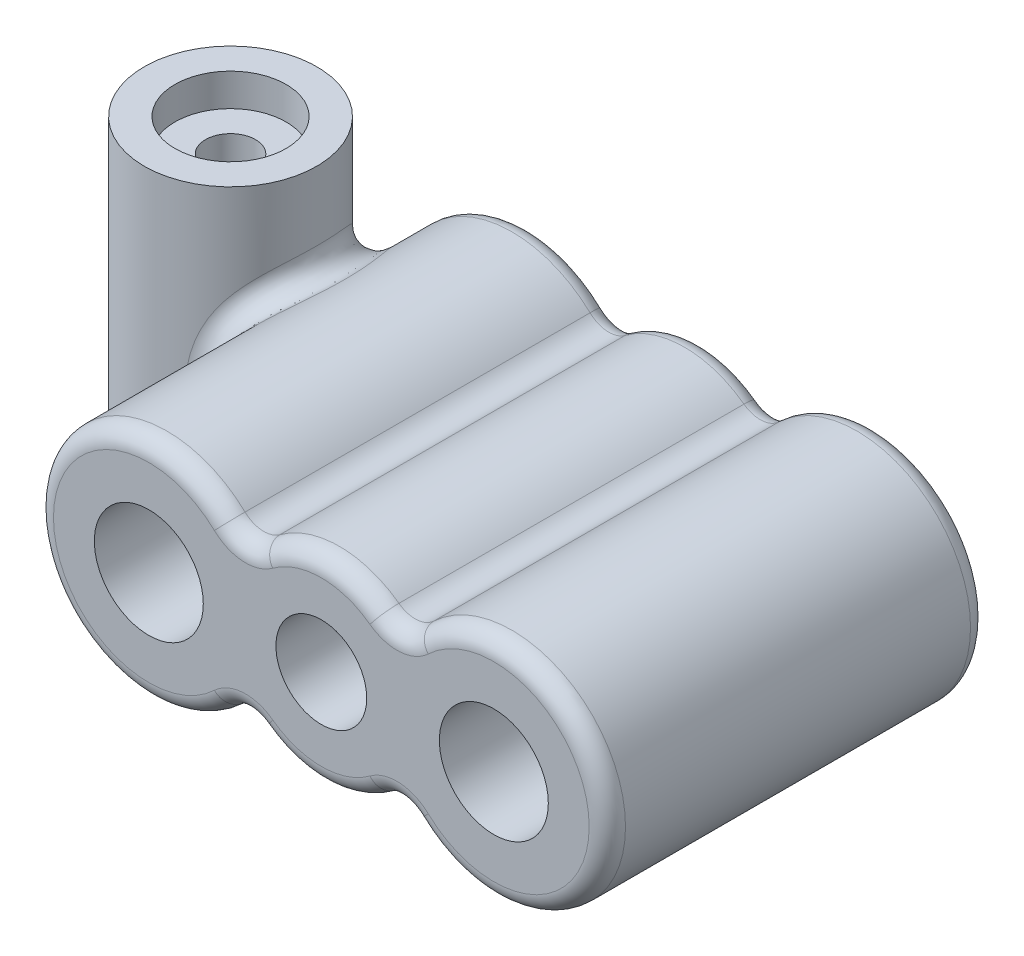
SolidWorks part; units mm, degrees
ref_plane "Front Plane" through (0, 0, 0) normal (0, 0, 1) x (1, 0, 0)
ref_plane "Top Plane" through (0, 0, 0) normal (0, 1, 0) x (1, 0, 0)
ref_plane "Right Plane" through (0, 0, 0) normal (1, 0, 0) x (0, 0, -1)
sketch "Sketch1" plane through (0, 0, 0) normal (0, 0, 1) x (1, 0, 0)
  line L0 (0, 0) -> (38, 0) construction
  arc A0 (10.4276, 6.8931) -> (10.4276, -6.8931) centre (0, 0) ccw
  arc A1 (10.4276, -6.8931) -> (27.5724, -6.8931) centre (19, 0) ccw
  arc A2 (27.5724, -6.8931) -> (27.5724, 6.8931) centre (38, 0) ccw
  arc A3 (27.5724, 6.8931) -> (10.4276, 6.8931) centre (19, 0) ccw
  dimension "D1" = 22
  dimension "D2" = 25
  dimension "D3" = 38
extrude "Boss-Extrude1" add sketch "Sketch1" along normal blind 42
sketch "Sketch2" plane through (0, 0, 0) normal (0, 1, 0) x (1, 0, 0)
  line L1 (10.4276, 0) -> (-12.5, 0) construction
  line L2 (19, -42) -> (19, 0) construction
  circle A0 centre (-19, -14) radius 9.5
  dimension "D1" = 19
  dimension "D3" = 38
  dimension "D2" = 14
extrude "Boss-Extrude2" add sketch "Sketch2" along normal mid plane 40
hole_wizard "Ø12.0 (12) Diameter Hole1" positions "Sketch4" profile "Sketch3" hole size "Ø12.0" standard "ANSI Metric"
sketch "Sketch4" plane through (0, 0, 42) normal (0, 0, 1) x (1, 0, 0)
  point P0 (0, 0)
  point P3 (38, 0)
sketch "Sketch3" plane through (0, 0, 42) normal (1, 0, 0) x (0, -1, 0)
  line L0 (0, 0) -> (0, 42)
  line L1 (0, 42) -> (6, 42)
  line L2 (6, 42) -> (6, 0)
  line L5 (6, 0) -> (0, 0)
  line L11 (0, -6.35) -> (0, 107.95) construction
  dimension "Thru Hole Dia." = 12
  dimension "Thru Hole Depth" = 42
hole_wizard "Ø10.0 (10) Diameter Hole1" positions "Sketch7" profile "Sketch6" hole size "Ø10.0" standard "ANSI Metric"
sketch "Sketch7" plane through (0, 0, 42) normal (0, 0, 1) x (1, 0, 0)
  point P0 (19, 0)
sketch "Sketch6" plane through (19, 0, 42) normal (1, 0, 0) x (0, -1, 0)
  line L0 (0, 0) -> (0, 42)
  line L1 (0, 42) -> (5, 42)
  line L2 (5, 42) -> (5, 0)
  line L5 (5, 0) -> (0, 0)
  line L11 (0, -6.35) -> (0, 107.95) construction
  dimension "Thru Hole Dia." = 10
  dimension "Thru Hole Depth" = 42
hole_wizard "CBORE for M5 Hex Head Bolt1" positions "Sketch9" profile "Sketch8" counterbore size "M5" standard "ANSI Metric"
sketch "Sketch9" plane through (0, 20, 0) normal (0, 1, 0) x (1, 0, 0)
  point P0 (-19, -14)
sketch "Sketch8" plane through (-19, 20, 14) normal (1, 0, 0) x (0, 0, 1)
  line L0 (0, 0) -> (0, 40)
  line L1 (0, 40) -> (2.75, 40)
  line L3 (2.75, 40) -> (2.75, 3.58)
  line L4 (2.75, 3.58) -> (6.12, 3.58)
  line L5 (6.12, 3.58) -> (6.12, 0)
  line L7 (6.12, 0) -> (0, 0)
  line L11 (0, -6.35) -> (0, 107.95) construction
  dimension "Thru Hole Dia." = 5.5
  dimension "Thru Hole Depth" = 40
  dimension "C'Bore Dia." = 12.24
  dimension "C'Bore Depth" = 3.58
fillet "Fillet1" radius 3 4 edges at (10.4276, -6.8931, 21) (27.5724, -6.8931, 21) (27.5724, 6.8931, 21) (10.4276, 6.8931, 21)
fillet "Fillet2" radius 2 17 edges at (10.4831, 8.2536, 0) (19, 11, 0) (27.5169, 8.2536, 0) (50.5, 0, 0) (27.5169, -8.2536, 0) (19, -11, 0) (10.4831, -8.2536, 0) (10.4831, 8.2536, 42) (19, 11, 42) (27.5169, 8.2536, 42) (50.5, 0, 42) (27.5169, -8.2536, 42) (19, -11, 42) (10.4831, -8.2536, 42) (-12.3593, -1.8704, 7.2066) (-12.5, 0, 0) (-12.5, 0, 42)
